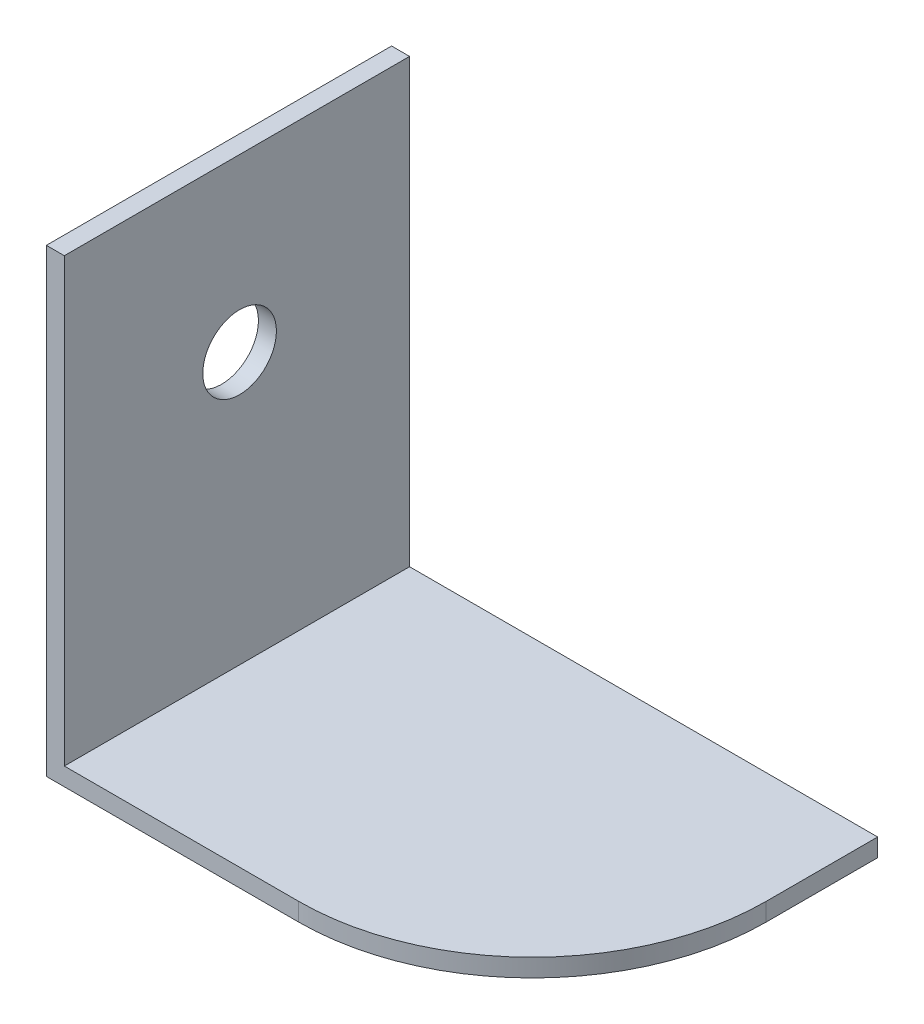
SolidWorks part; units mm, degrees
ref_plane "Front Plane" through (0, 0, 0) normal (0, 0, 1) x (1, 0, 0)
ref_plane "Top Plane" through (0, 0, 0) normal (0, 1, 0) x (1, 0, 0)
ref_plane "Right Plane" through (0, 0, 0) normal (1, 0, 0) x (0, 0, -1)
sketch "Sketch1" plane through (0, 0, 0) normal (0, 0, 1) x (1, 0, 0)
  line L0 (0, 64.9734) -> (0, 0)
  line L1 (0, 0) -> (68.6608, 0)
extrude "Extrude-Thin1" add sketch "Sketch1" along normal blind 48.768 thin
sketch "Sketch2" plane through (2.54, 0, 0) normal (1, 0, 0) x (0, 0, -1)
  circle A0 centre (-24.0117, 40.7938) radius 5.1998
extrude "Cut-Extrude1" cut sketch "Sketch2" against normal through all
fillet "Fillet1" radius 33.02 1 edges at (68.6608, 1.27, 48.768)
